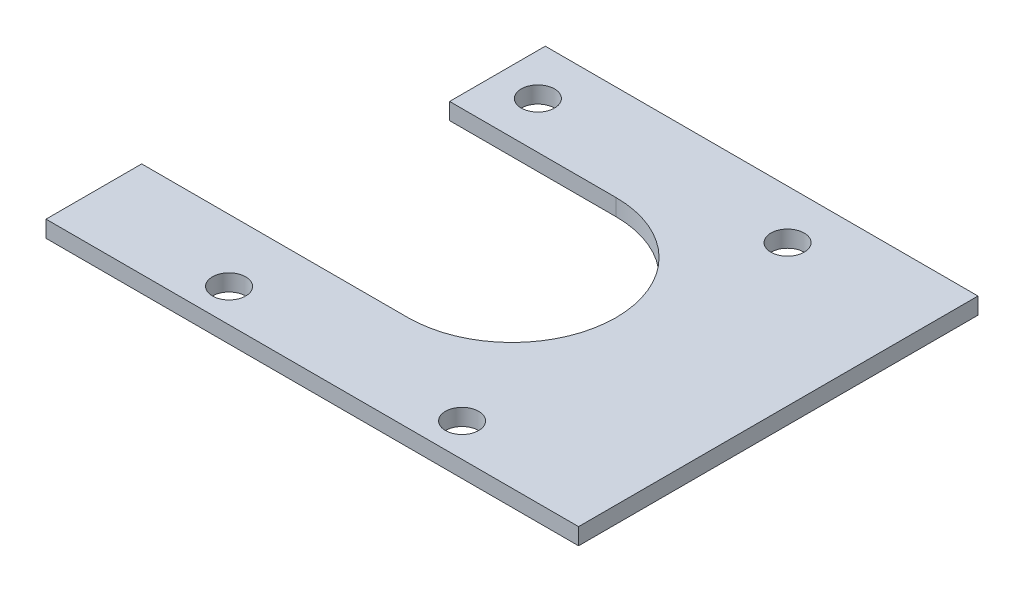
SolidWorks part; units mm, degrees
ref_plane "Front" through (0, 0, 0) normal (0, 0, 1) x (1, 0, 0)
ref_plane "Top" through (0, 0, 0) normal (0, 1, 0) x (1, 0, 0)
ref_plane "Right" through (0, 0, 0) normal (1, 0, 0) x (0, 0, -1)
sketch "Sketch1" plane through (0, 0, 0) normal (0, 1, 0) x (1, 0, 0)
  line L0 (25.4, 19.05) -> (-15.875, 19.05)
  line L2 (-25.4, -9.9219) -> (-25.4, -50.8)
  line L3 (-25.4, -50.8) -> (25.4, -50.8)
  line L4 (25.4, 19.05) -> (25.4, -50.8)
  line L5 (0, 0) -> (0, -50.8) construction
  line L6 (9.9219, 0) -> (15.875, 0) construction
  line L7 (0, -9.9219) -> (-25.4, -9.9219)
  line L10 (0, 9.9219) -> (-15.875, 9.9219)
  line L11 (-15.875, 9.9219) -> (-15.875, 19.05)
  line L12 (0, 15.875) -> (0, 9.9219) construction
  circle A0 centre (0, 0) radius 7.3025 construction
  arc A1 (0, -9.9219) -> (9.9219, 0) centre (0, 0) ccw
  arc A2 (15.875, 0) -> (-12.3924, 9.9219) centre (0, 0) ccw construction
  arc A3 (9.9219, 0) -> (0, 9.9219) centre (0, 0) ccw
  dimension "D4" = 14.605
  dimension "D5" = 19.8438
  dimension "D6" = 19.05
  dimension "D1" = 15.875
  dimension "D2" = 50.8
  dimension "D3" = 50.8
  dimension "D7" = 40.8781
extrude "Boss-Extrude1" add sketch "Sketch1" along normal blind 1.5875
sketch "Sketch2" plane through (0, 1.5875, 0) normal (0, 1, 0) x (1, 0, 0)
  circle A0 centre (0, 12.7) radius 0.127
  circle A1 centre (12.7, 0) radius 0.127
  circle A2 centre (0, 0) radius 12.7 construction
  dimension "D1" = 0.254
  dimension "D2" = 25.4
sketch "Sketch5" plane through (0, 1.5875, 0) normal (0, 1, 0) x (1, 0, 0)
  line L0 (25.4, 19.05) -> (-15.875, 19.05) construction
  circle A0 centre (11.9062, 14.3764) radius 1.5875
  circle A1 centre (-11.9063, 14.3764) radius 1.5875
  circle A4 centre (0, 0) radius 14.4217 construction
  circle A5 centre (11.1125, -15.875) radius 1.5875
  circle A6 centre (-11.1125, -15.875) radius 1.5875
  dimension "D1" = 3.175
  dimension "D6" = 3.175
  dimension "D2" = 4.6736
  dimension "D3" = 11.9062
  dimension "D4" = 11.9062
  dimension "D7" = 11.1125
  dimension "D8" = 11.1125
  dimension "D9" = 15.875
extrude "Cut-Extrude2" cut sketch "Sketch5" against normal through all
sketch "Sketch6" plane through (0, 1.5875, 0) normal (0, 1, 0) x (1, 0, 0)
  line L0 (15.0813, -19.05) -> (-15.0812, -19.05) construction
  line L1 (31.7054, -59.5295) -> (-44.1091, -59.5295)
  line L2 (31.7054, -59.5295) -> (31.7054, -19.05)
  line L3 (31.7054, -19.05) -> (-44.1091, -19.05)
  line L4 (-44.1091, -59.5295) -> (-44.1091, -19.05)
extrude "Cut-Extrude3" cut sketch "Sketch6" against normal through all
equation "\"Buoyancy\"=\"SW-Volume\"*(\"SW-Density\"-.037062)"
